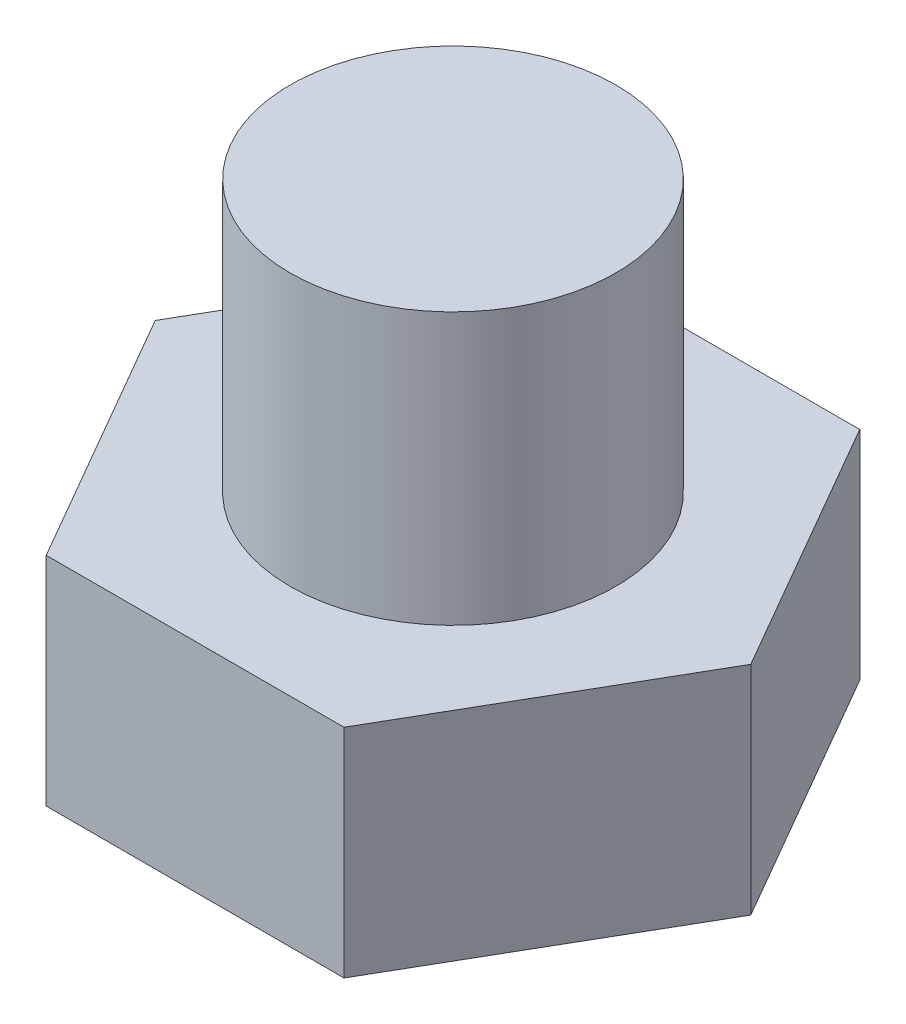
SolidWorks part; units mm, degrees
ref_plane "Front Plane" through (0, 0, 0) normal (0, 0, 1) x (1, 0, 0)
ref_plane "Top Plane" through (0, 0, 0) normal (0, 1, 0) x (1, 0, 0)
ref_plane "Right Plane" through (0, 0, 0) normal (1, 0, 0) x (0, 0, -1)
sketch "Sketch1" plane through (0, 0, 0) normal (0, 1, 0) x (1, 0, 0)
  line L1 (5.4848, 9.5) -> (-5.4848, 9.5)
  line L2 (-5.4848, 9.5) -> (-10.9697, 0)
  line L3 (-10.9697, 0) -> (-5.4848, -9.5)
  line L4 (-5.4848, -9.5) -> (5.4848, -9.5)
  line L5 (5.4848, -9.5) -> (10.9697, 0)
  line L6 (10.9697, 0) -> (5.4848, 9.5)
  circle A0 centre (0, 0) radius 9.5 construction
  dimension "D1" = 19
extrude "Boss-Extrude1" add sketch "Sketch1" along normal blind 8
sketch "Sketch2" plane through (0, 8, 0) normal (0, 1, 0) x (1, 0, 0)
  circle A0 centre (0, 0) radius 6
  dimension "D1" = 12
extrude "Boss-Extrude2" add sketch "Sketch2" along normal blind 10
